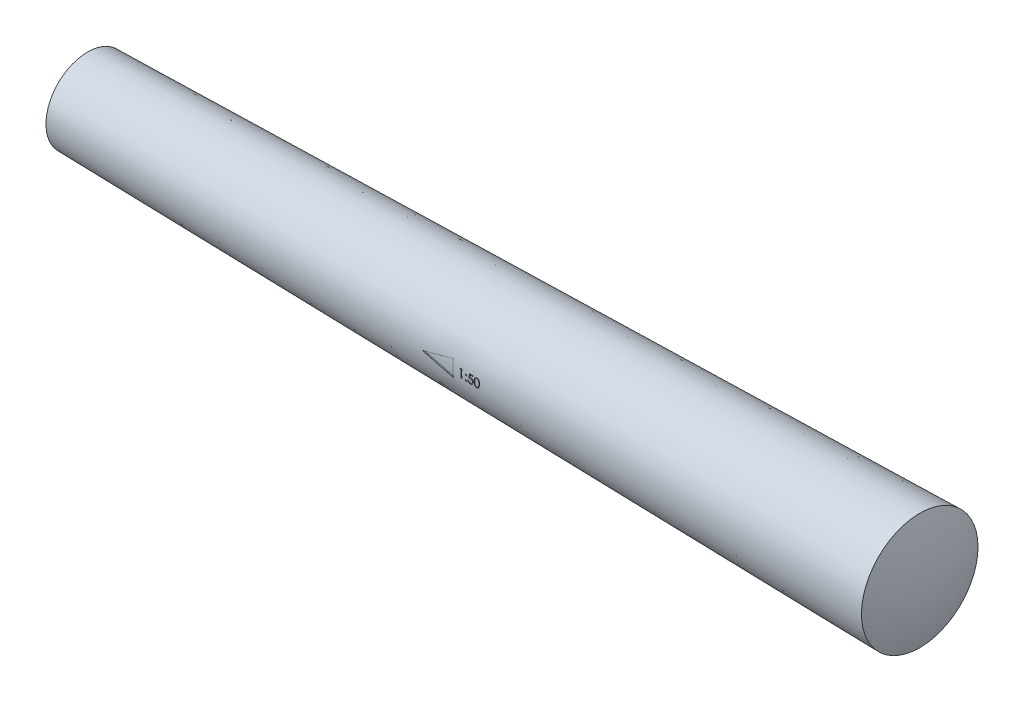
SolidWorks part; units mm, degrees
ref_plane "Front Plane" through (0, 0, 0) normal (0, 0, 1) x (1, 0, 0)
ref_plane "Top Plane" through (0, 0, 0) normal (0, 1, 0) x (1, 0, 0)
ref_plane "Right Plane" through (0, 0, 0) normal (1, 0, 0) x (0, 0, -1)
sketch "Sketch1" plane through (0, 0, 0) normal (1, 0, 0) x (0, 0, -1)
  circle A0 centre (0, 0) radius 5
  dimension "D1" = 10
extrude "Extrude1" add sketch "Sketch1" along normal mid plane 100
draft "Draft1" type of draft neutral plane draft angle 1.146 faces to draft 1 parameters "D1"=1.146
sketch "Sketch2" plane through (0, 0, 0) normal (0, 0, 1) x (1, 0, 0)
  line L0 (-50, 0) -> (-50, 5)
  line L1 (-50, 5) -> (-50, -5) construction
  line L2 (-50, 0) -> (-51.2, 0)
  line L3 (-51.2, 0) -> (-51.2, -6) construction
  line L4 (50, 0) -> (50, 7.0001)
  line L5 (50, -7.0001) -> (50, 7.0001) construction
  line L6 (50, 0) -> (51.2, 0)
  line L7 (51.2, 0) -> (51.2, -6) construction
  line L8 (-50, -5) -> (50, -7.0001) construction
  arc A0 (-51.2, 0) -> (-50, 5) centre (-40.1833, 0) cw
  arc A1 (51.2, 0) -> (50, 7.0001) centre (30.183, 0) ccw
  point P14 (0, -6)
revolve "Revolve1" add sketch "Sketch2" angle 360 about L2
sketch "Sketch5" plane through (0, 0, 0) normal (0, 0, 1) x (1, 0, 0)
  line L0 (0, 6) -> (0, -6) construction
  line L1 (50, 7.0001) -> (-50, 5) construction
  line L2 (-50, -5) -> (50, -7.0001) construction
ref_plane "Plane2" through (0, 0, 0) normal (-0.02, 0, 0.9998) x (0.9998, 0, 0.02)
sketch "Sketch6" plane through (0, 0, 0) normal (-0.02, 0, 0.9998) x (0.9998, 0, 0.02)
  line L0 (0, 0) -> (0, 1)
  line L1 (0, 6) -> (0, -6) construction
  line L2 (0, 1) -> (-3.7321, 0)
  line L3 (-3.7321, 0) -> (0, -1)
  line L4 (0, -1) -> (0, 0)
  line L5 (0, -0.5) -> (4, -0.5) construction
  text T0 "1:50" font "Century Gothic" height 1
  dimension "D1" = 2
  dimension "D2" = 30
  dimension "D3" = 4
wrap "Wrap2" sketch "Sketch6" wrap type deboss source sketch "Sketch6" thickness 0.1 parameters "D1"=0.1
equation "\"D2@Sketch2\" = \"D1@Sketch2\""
